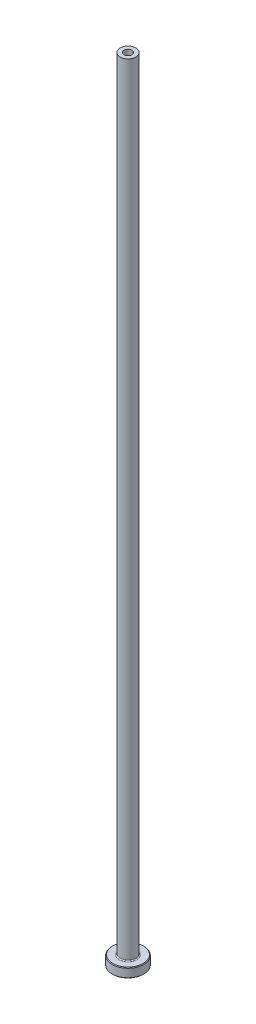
SolidWorks part; units mm, degrees
ref_plane "Front Plane" through (0, 0, 0) normal (0, 0, 1) x (1, 0, 0)
ref_plane "Top Plane" through (0, 0, 0) normal (0, 1, 0) x (1, 0, 0)
ref_plane "Right Plane" through (0, 0, 0) normal (1, 0, 0) x (0, 0, -1)
sketch "Sketch1" plane through (0, 0, 0) normal (0, 0, 1) x (1, 0, 0)
  line L0 (-1.25, 250) -> (-2.5, 250)
  line L1 (-2.5, 250) -> (-2.5, 3)
  line L2 (-2.5, 3) -> (-5, 3)
  line L3 (-5, 3) -> (-5, 0)
  line L4 (5.5, 0) -> (-5.5, 0) construction
  line L5 (-5, 0) -> (-1.5, 0)
  line L6 (-1.25, 215) -> (-1.25, 250)
  line L7 (0, 92.1877) -> (0, -15.5353) construction
  line L8 (0, -5.5) -> (0, 5.5) construction
  line L9 (-1.25, 215) -> (-1.5, 203)
  line L10 (-1.5, 203) -> (-1.5, 0)
  dimension "D1" = 0.25
  dimension "ID" = 2.5
  dimension "OD" = 5
  dimension "L" = 250
  dimension "H" = 10
  dimension "T" = 3
  dimension "N" = 35
  dimension "D2" = 12
revolve "Revolve1" add sketch "Sketch1" angle 360 about L7
fillet "Fillet1" radius 0.3 1 edges at (0, 3, 2.5)
chamfer "Chamfer1" distance 0.2 angle 45 2 edges at (0, 3, 5) (0, 0, 5)
chamfer "Chamfer3" distance 0.5 angle 45 1 edges at (0, 0, 1.5)
